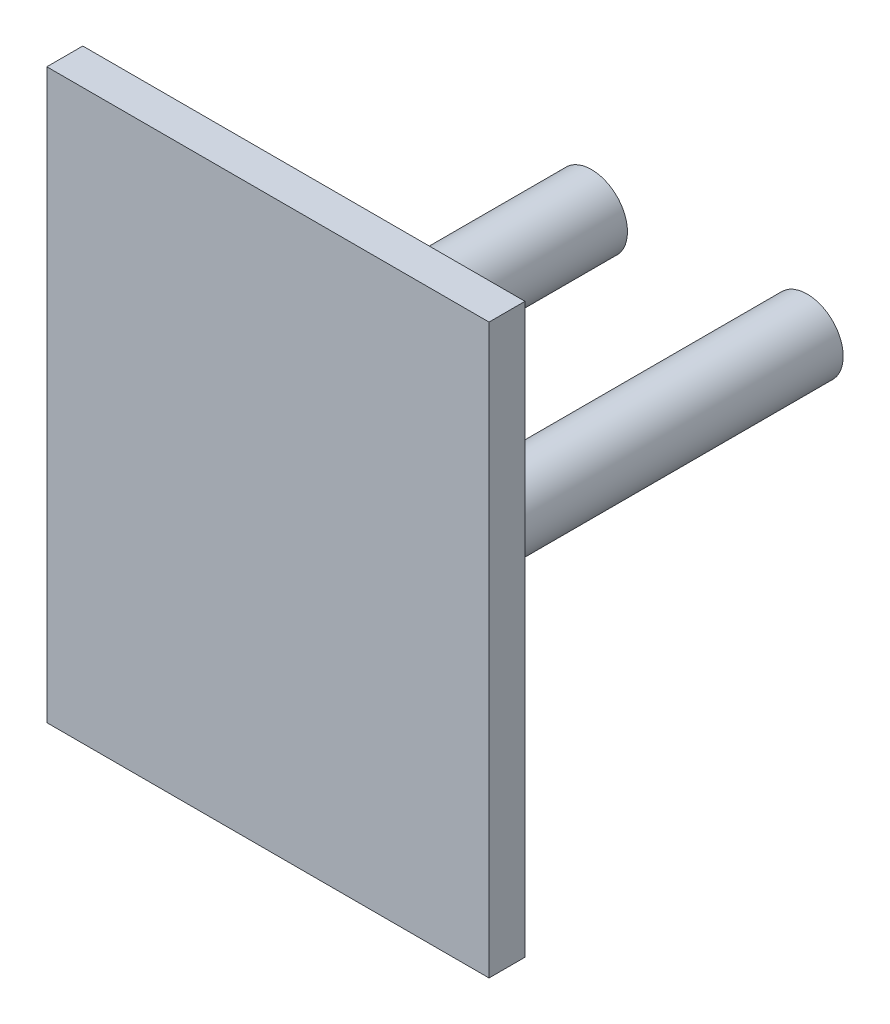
SolidWorks part; units mm, degrees
ref_plane "Face" through (0, 0, 0) normal (0, 0, 1) x (1, 0, 0)
ref_plane "Dessus" through (0, 0, 0) normal (0, 1, 0) x (1, 0, 0)
ref_plane "Droite" through (0, 0, 0) normal (1, 0, 0) x (0, 0, -1)
sketch "Esquisse1" plane through (0, 0, 0) normal (0, 0, 1) x (1, 0, 0)
  line L0 (-84.1549, 0) -> (84.1549, 0) construction
  line L1 (0, 74.5253) -> (0, -82.8989) construction
  line L2 (-61.5, -79) -> (-61.5, 79)
  line L3 (0, 79) -> (-61.5, 79)
  line L4 (0, -79) -> (61.5, -79)
  line L5 (0, 79) -> (61.5, 79)
  line L6 (61.5, -79) -> (61.5, 79)
  line L7 (0, -79) -> (-61.5, -79)
  point P11 (61.5, 0)
  point P13 (-61.5, 0)
  dimension "D1" = 61.5
  dimension "D2" = 79
extrude "Extrusion1" add sketch "Esquisse1" along normal blind 10
sketch "Esquisse2" plane through (0, 0, 10) normal (0, 0, 1) x (1, 0, 0)
  line L0 (-84.3166, 0) -> (70.4719, 0) construction
  line L1 (0, 86.6997) -> (0, -86.6997) construction
  circle A0 centre (30, 0) radius 10
  circle A1 centre (-30, 0) radius 10
  dimension "D2" = 20
  dimension "D1" = 30
extrude "Extrusion2" add sketch "Esquisse2" against normal blind 120
